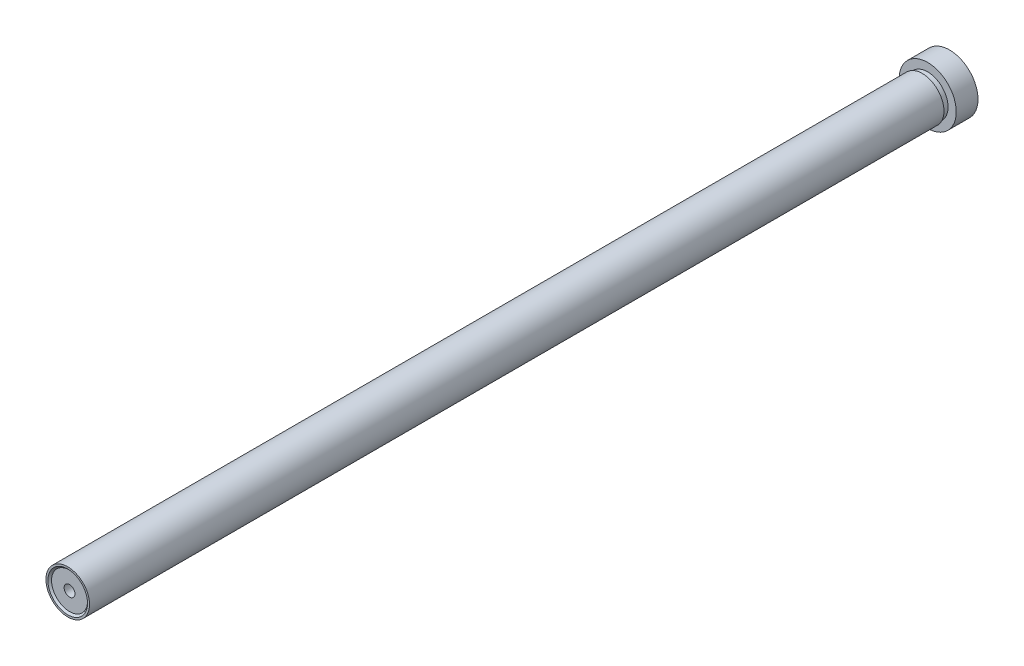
SolidWorks part; units mm, degrees
ref_plane "Спереди" through (0, 0, 0) normal (0, 0, 1) x (1, 0, 0)
ref_plane "Сверху" through (0, 0, 0) normal (0, 1, 0) x (1, 0, 0)
ref_plane "Справа" through (0, 0, 0) normal (1, 0, 0) x (0, 0, -1)
sketch "Эскиз1" plane through (0, 0, 0) normal (0, 0, 1) x (1, 0, 0)
  circle A0 centre (0, 0) radius 10.5
  dimension "D1" = 21
extrude "Бобышка-Вытянуть1" add sketch "Эскиз1" along normal blind 8
sketch "Эскиз2" plane through (0, 0, 8) normal (0, 0, 1) x (1, 0, 0)
  circle A0 centre (0, 0) radius 7.5
  dimension "D1" = 15
extrude "Бобышка-Вытянуть2" add sketch "Эскиз2" along normal blind 2
sketch "Эскиз3" plane through (0, 0, 10) normal (0, 0, 1) x (1, 0, 0)
  circle A0 centre (0, 0) radius 8
  dimension "D1" = 16
extrude "Бобышка-Вытянуть3" add sketch "Эскиз3" along normal blind 314
sketch "Эскиз4" plane through (0, 0, 0) normal (0, 0, -1) x (-1, 0, 0)
  circle A0 centre (0, 0) radius 2.75
  dimension "D1" = 5.5
extrude "Вырез-Вытянуть1" cut sketch "Эскиз4" against normal blind 313
sketch "Эскиз5" plane through (0, 0, 0) normal (0, 0, -1) x (-1, 0, 0)
  circle A0 centre (0, 0) radius 5.1
  circle A1 centre (0, 0) radius 8.1
  dimension "D1" = 10.2
  dimension "D2" = 16.2
extrude "Вырез-Вытянуть2" cut sketch "Эскиз5" against normal blind 1.9
sketch "Эскиз6" plane through (0, 0, 324) normal (0, 0, 1) x (1, 0, 0)
  circle A0 centre (0, 0) radius 7.285
  dimension "D1" = 14.57
extrude "Вырез-Вытянуть3" cut sketch "Эскиз6" against normal blind 0.67 draft 45
sketch "Эскиз7" plane through (0, 0, 323.33) normal (0, 0, 1) x (1, 0, 0)
  circle A0 centre (0, 0) radius 2
  dimension "D1" = 4
extrude "Вырез-Вытянуть4" cut sketch "Эскиз7" against normal blind 3
sketch "Эскиз8" plane through (0, 0, 320.33) normal (0, 0, 1) x (1, 0, 0)
  circle A0 centre (0, 0) radius 2
  dimension "D1" = 4
extrude "Вырез-Вытянуть5" cut sketch "Эскиз8" against normal blind 2 draft 60
sketch "Эскиз9" plane through (0, 0, 313) normal (0, 0, -1) x (-1, 0, 0)
  circle A0 centre (0, 0) radius 2.75
  dimension "D1" = 5.5
extrude "Вырез-Вытянуть6" cut sketch "Эскиз9" against normal blind 3 draft 60
